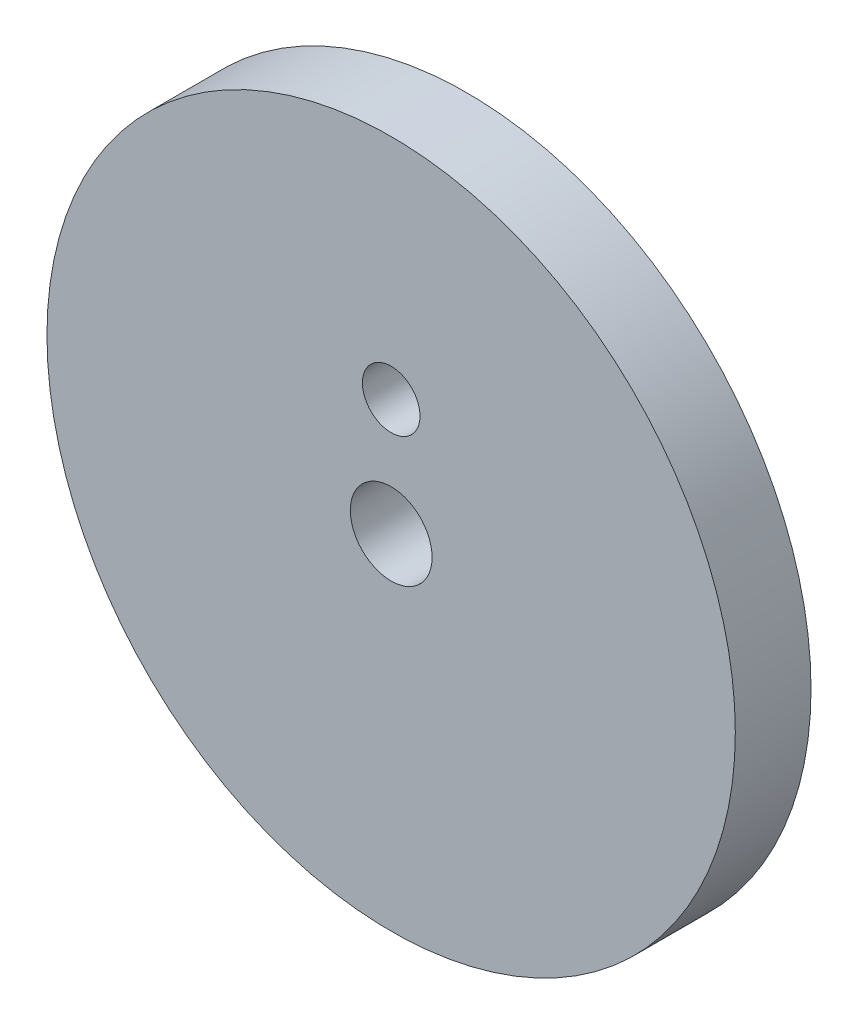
SolidWorks part; units mm, degrees
ref_plane "Front Plane" through (0, 0, 0) normal (0, 0, 1) x (1, 0, 0)
ref_plane "Top Plane" through (0, 0, 0) normal (0, 1, 0) x (1, 0, 0)
ref_plane "Right Plane" through (0, 0, 0) normal (1, 0, 0) x (0, 0, -1)
sketch "Base Outline" plane through (0, 0, 0) normal (0, 0, 1) x (1, 0, 0)
  circle A0 centre (0, 0) radius 40
extrude "Extrude Base" add sketch "Base Outline" along normal blind 8.8
sketch "Tripod Mount Outline" plane through (0, 0, 8.8) normal (0, 0, 1) x (1, 0, 0)
  circle A0 centre (0.0052, 0.0015) radius 4.75
  circle A1 centre (0.0052, 13.5299) radius 3.3454
extrude "Cut Tripod Holes" cut sketch "Tripod Mount Outline" against normal blind 8
sketch "Camera Mount Outline" plane through (0, 0, 0) normal (0, 0, -1) x (-1, 0, 0)
  circle A1 centre (0, 32.7477) radius 3.1
  circle A2 centre (28.3603, -16.3738) radius 3.1
  circle A3 centre (-28.3603, -16.3738) radius 3.1
  dimension "D1" = 3
extrude "Cut Camera Holes" cut sketch "Camera Mount Outline" against normal blind 8
